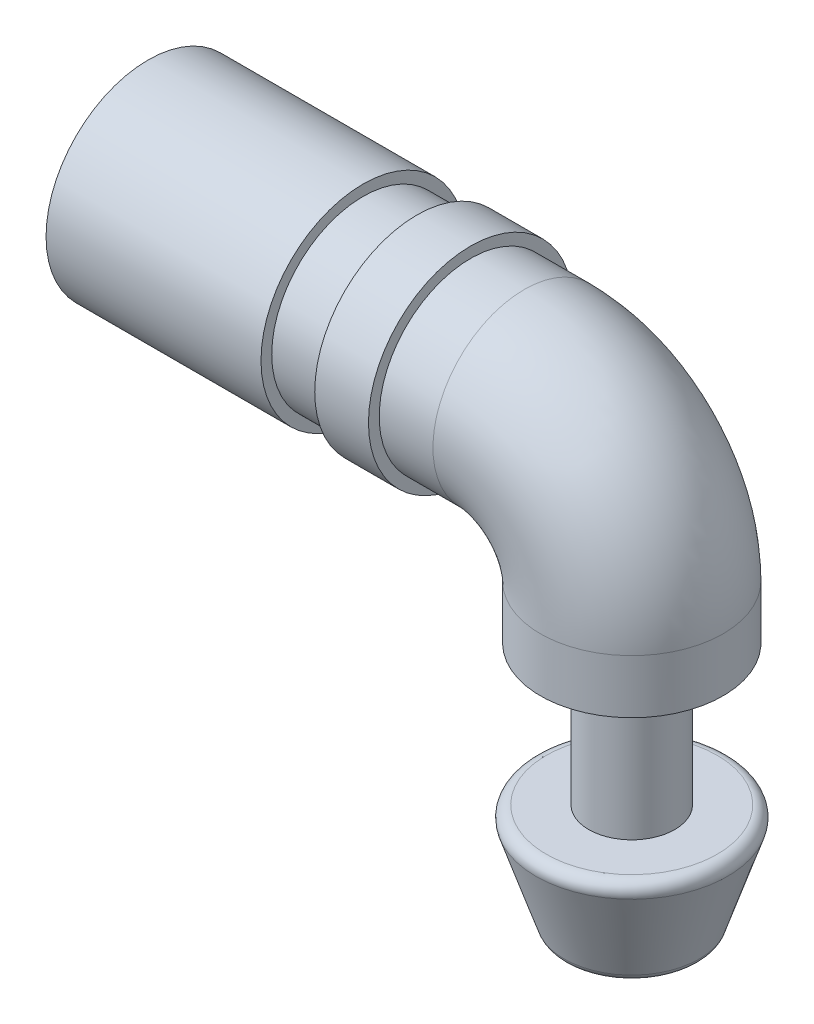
SolidWorks part; units mm, degrees
ref_plane "Alzado" through (0, 0, 0) normal (0, 0, 1) x (1, 0, 0)
ref_plane "Planta" through (0, 0, 0) normal (0, 1, 0) x (1, 0, 0)
ref_plane "Vista lateral" through (0, 0, 0) normal (1, 0, 0) x (0, 0, -1)
sketch "Croquis1" plane through (0, 0, 0) normal (0, 0, 1) x (1, 0, 0)
  line L0 (0, 0) -> (28.3235, 0) construction
  line L1 (0, 0) -> (0, 9.5)
  line L2 (0, 9.5) -> (20, 9.5)
  line L3 (20, 9.5) -> (20, 8.5)
  line L4 (20, 8.5) -> (25, 8.5)
  line L5 (25, 8.5) -> (25, 9.5)
  line L6 (25, 9.5) -> (30, 9.5)
  line L7 (30, 9.5) -> (30, 0)
  line L8 (30, 0) -> (0, 0)
  dimension "D1" = 19
  dimension "D2" = 20
  dimension "D3" = 1
  dimension "D4" = 5
revolve "Revolución1" add sketch "Croquis1" angle 360 about L0
ref_plane "Plano1" through (0, 0, 8.5) normal (0, 0, 1) x (1, 0, 0)
sketch "Croquis2" plane through (0, 0, 8.5) normal (0, 0, 1) x (1, 0, 0)
  line L0 (30, 0) -> (35, 0)
  line L1 (30, -9.5) -> (30, 9.5) construction
  line L2 (45, -10) -> (45, -15.0029)
  arc A0 (45, -10) -> (35, 0) centre (35, -10) ccw
  point P8 (45, 0)
  dimension "D2" = 10
  dimension "D1" = 15
sketch "Croquis3" plane through (30, 0, 0) normal (1, 0, 0) x (0, 0, -1)
  circle A0 centre (0, 0) radius 8.5
sweep "Barrer1" add profiles "Croquis3" path "Croquis2"
sketch "Croquis4" plane through (0, 0, 0) normal (0, 0, 1) x (1, 0, 0)
  line L0 (45, -15.0029) -> (45, -38.0029) construction
  line L1 (36.5, -15.0029) -> (53.5, -15.0029) construction
  line L2 (45, -15.0029) -> (49, -15.0029)
  line L3 (49, -15.0029) -> (49, -28.0271)
  line L4 (49, -28.0271) -> (54.3492, -28.0271)
  line L5 (54.3492, -28.0271) -> (51.048, -38.0029)
  line L6 (51.048, -38.0029) -> (45, -38.0029)
  line L7 (45, -38.0029) -> (45, -15.0029)
  point P4 (49, -27.5331)
  point P9 (51.048, -30.003)
  point P10 (53.0959, -31.8143)
  point P11 (49, -28.0271)
  dimension "D1" = 23
  dimension "D2" = 8
revolve "Revolución2" add sketch "Croquis4" angle 360 about L0
fillet "Redondeo1" radius 1 2 edges at (45, -38.0029, 6.048) (45, -28.0271, 9.3492)
